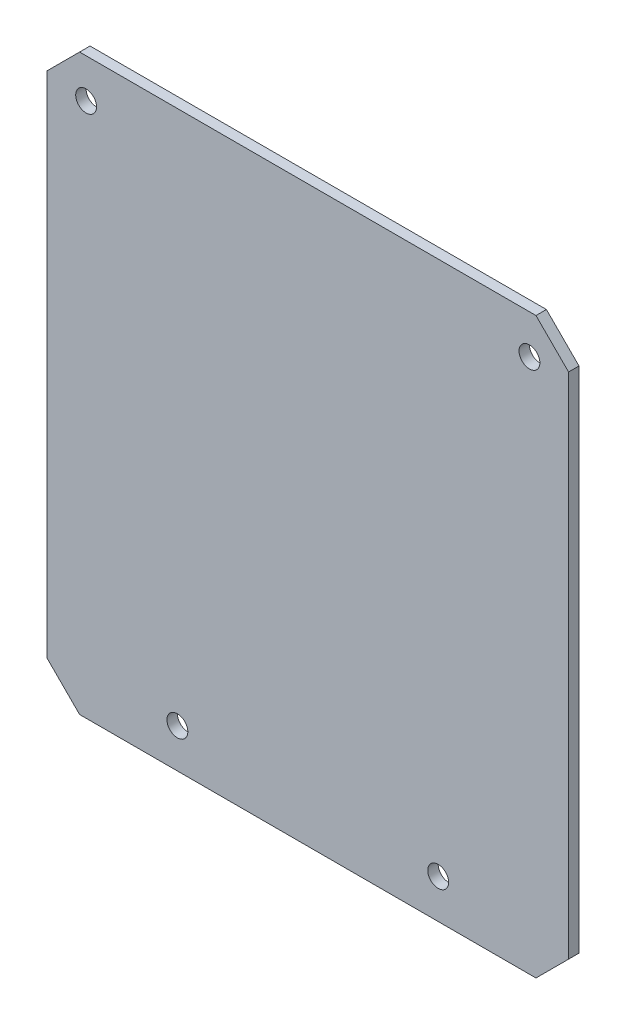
SolidWorks part; units mm, degrees
ref_plane "前视基准面" through (0, 0, 0) normal (0, 0, 1) x (1, 0, 0)
ref_plane "上视基准面" through (0, 0, 0) normal (0, 1, 0) x (1, 0, 0)
ref_plane "右视基准面" through (0, 0, 0) normal (1, 0, 0) x (0, 0, -1)
other "Configuration Table"
sketch "草图1" plane through (0, 0, 0) normal (0, 0, 1) x (1, 0, 0)
  line L0 (-33.5, -49.5) -> (36.5, -49.5)
  line L1 (36.5, -49.5) -> (41.5, -44.5)
  line L2 (41.5, -44.5) -> (41.5, 33.5)
  line L3 (41.5, 33.5) -> (36.5, 38.5)
  line L4 (36.5, 38.5) -> (-33.5, 38.5)
  line L5 (-33.5, 38.5) -> (-38.5, 33.5)
  line L6 (-38.5, 33.5) -> (-38.5, -44.5)
  line L7 (-38.5, -44.5) -> (-33.5, -49.5)
  circle A0 centre (-32.5, 32.5) radius 1.6
  circle A1 centre (35.5, 32.5) radius 1.6
  circle A2 centre (-18.5, -43.5) radius 1.6
  circle A3 centre (21.5, -43.5) radius 1.6
  dimension "D1" = 3.2
  dimension "D2" = 21.5
  dimension "D3" = 35.5
  dimension "D4" = 36.5
  dimension "D5" = 41.5
  dimension "D6" = 18.5
  dimension "D7" = 32.5
  dimension "D8" = 33.5
  dimension "D9" = 32.5
  dimension "D10" = 33.5
  dimension "D11" = 38.5
  dimension "D12" = 43.5
  dimension "D13" = 44.5
extrude "Reference_PCB_assumed_1p6" add sketch "草图1" along normal blind 1.6
